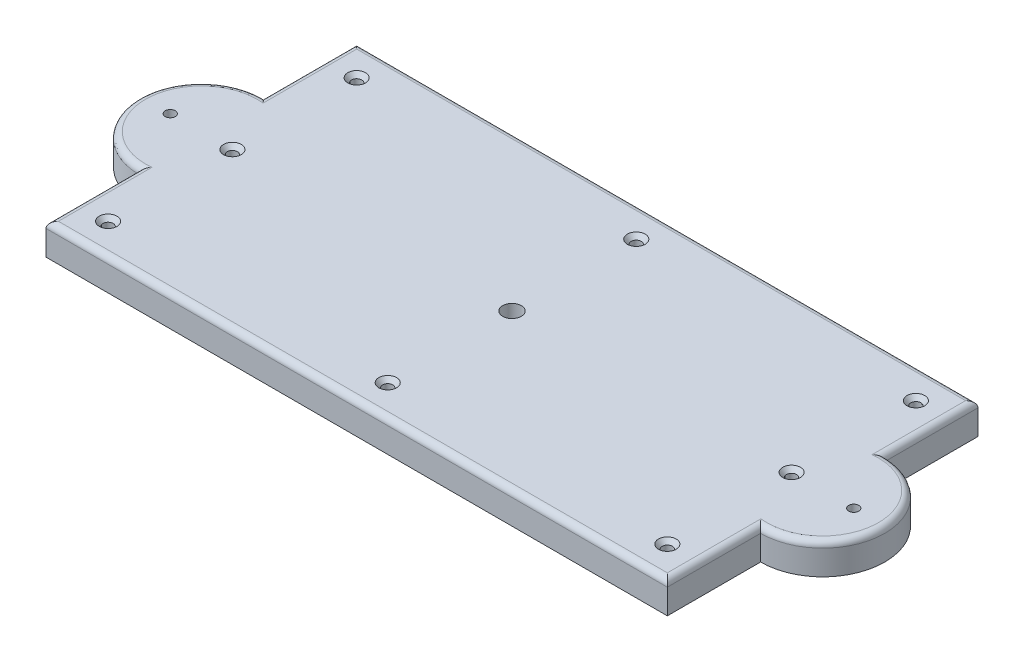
SolidWorks part; units mm, degrees
ref_plane "Front Plane" through (0, 0, 0) normal (0, 0, 1) x (1, 0, 0)
ref_plane "Top Plane" through (0, 0, 0) normal (0, 1, 0) x (1, 0, 0)
ref_plane "Right Plane" through (0, 0, 0) normal (1, 0, 0) x (0, 0, -1)
sketch "Sketch1" plane through (0, 0, 0) normal (0, 1, 0) x (1, 0, 0)
  line L0 (0, 0) -> (200, 0)
  line L5 (200, 0) -> (200, 30)
  line L6 (200, 70) -> (200, 100)
  line L7 (200, 100) -> (0, 100)
  line L8 (0, 100) -> (0, 70)
  line L9 (0, 30) -> (0, 0)
  arc A0 (200, 30) -> (200, 70) centre (200, 50) ccw
  arc A1 (0, 70) -> (0, 30) centre (0, 50) ccw
  dimension "D4" = 20
  dimension "D5" = 20
  dimension "D1" = 200
  dimension "D2" = 50
  dimension "D3" = 50
  dimension "D6" = 50
extrude "Boss-Extrude1" add sketch "Sketch1" along normal blind 10
sketch "Sketch2" plane through (0, 10, 0) normal (0, 1, 0) x (1, 0, 0)
  line L0 (0, 100) -> (0, 70) construction
  line L1 (200, 100) -> (0, 100) construction
  line L2 (200, 0) -> (200, 30) construction
  line L3 (0, 0) -> (200, 0) construction
  point P0 (10, 90)
  point P1 (10, 50)
  point P2 (10, 10)
  point P3 (100, 10)
  point P4 (190, 10)
  point P5 (190, 50)
  point P6 (190, 90)
  point P7 (100, 90)
hole_wizard "CSK for #4 Flat Head Machine Screw1" positions "Sketch3" profile "Sketch4" countersink size "#4" standard "ANSI Inch"
sketch "Sketch3" plane through (0, 10, 0) normal (0, 1, 0) x (1, 0, 0)
  point P0 (10, 90)
  point P3 (10, 50)
  point P6 (10, 10)
  point P9 (100, 90)
  point P12 (190, 90)
  point P15 (190, 50)
  point P18 (190, 10)
  point P21 (100, 10)
sketch "Sketch4" plane through (10, 10, -90) normal (1, 0, 0) x (0, 0, 1)
  line L0 (0, 0) -> (0, 10)
  line L1 (0, 10) -> (1.6319, 10)
  line L2 (1.6319, 10) -> (1.6319, 1.4098)
  line L3 (1.6319, 1.4098) -> (2.8575, 0)
  line L5 (2.8575, 0) -> (0, 0)
  line L6 (-1.6319, 1.4098) -> (-2.8575, 0) construction
  line L11 (0, -6.35) -> (0, 107.95) construction
  dimension "Thru Hole Dia." = 3.2639
  dimension "Thru Hole Depth" = 10
  dimension "Near C'Sink Dia." = 5.715
  dimension "Near C'Sink Angle" = 82
sketch "Sketch5" plane through (0, 0, 0) normal (0, -1, 0) x (1, 0, 0)
  line L0 (200, -100) -> (0, -100) construction
  point P0 (-10, -50)
  point P1 (210, -50)
  dimension "D1" = 50
  dimension "D2" = 10
  dimension "D3" = 10
hole_wizard "CSK for #4 Flat Head Machine Screw2" positions "Sketch6" profile "Sketch7" countersink size "#4" standard "ANSI Inch"
sketch "Sketch6" plane through (0, 0, 0) normal (0, -1, 0) x (-1, 0, 0)
  point P0 (-210, 50)
  point P3 (10, 50)
sketch "Sketch7" plane through (210, 0, -50) normal (1, 0, 0) x (0, 0, -1)
  line L0 (0, 0) -> (0, 10)
  line L1 (0, 10) -> (1.6319, 10)
  line L2 (1.6319, 10) -> (1.6319, 1.4098)
  line L3 (1.6319, 1.4098) -> (2.8575, 0)
  line L5 (2.8575, 0) -> (0, 0)
  line L6 (-1.6319, 1.4098) -> (-2.8575, 0) construction
  line L11 (0, -6.35) -> (0, 107.95) construction
  dimension "Thru Hole Dia." = 3.2639
  dimension "Thru Hole Depth" = 10
  dimension "Near C'Sink Dia." = 5.715
  dimension "Near C'Sink Angle" = 82
fillet "Fillet1" radius 2 8 edges at (-20, 10, -50) (0, 10, -85) (200, 10, -85) (220, 10, -50) (200, 10, -15) (100, 10, 0) (0, 10, -15) (100, 10, -100)
sketch "Sketch8" plane through (0, 10, 0) normal (0, 1, 0) x (1, 0, 0)
  circle A0 centre (100, 50) radius 3
  dimension "D1" = 6
extrude "Cut-Extrude1" cut sketch "Sketch8" against normal blind 10 contours A0
equation "\"D2@Sketch2\"=\"D1@Sketch2\""
equation "\"D3@Sketch2\"=\"D1@Sketch2\""
equation "\"D4@Sketch2\"=\"D1@Sketch2\""
